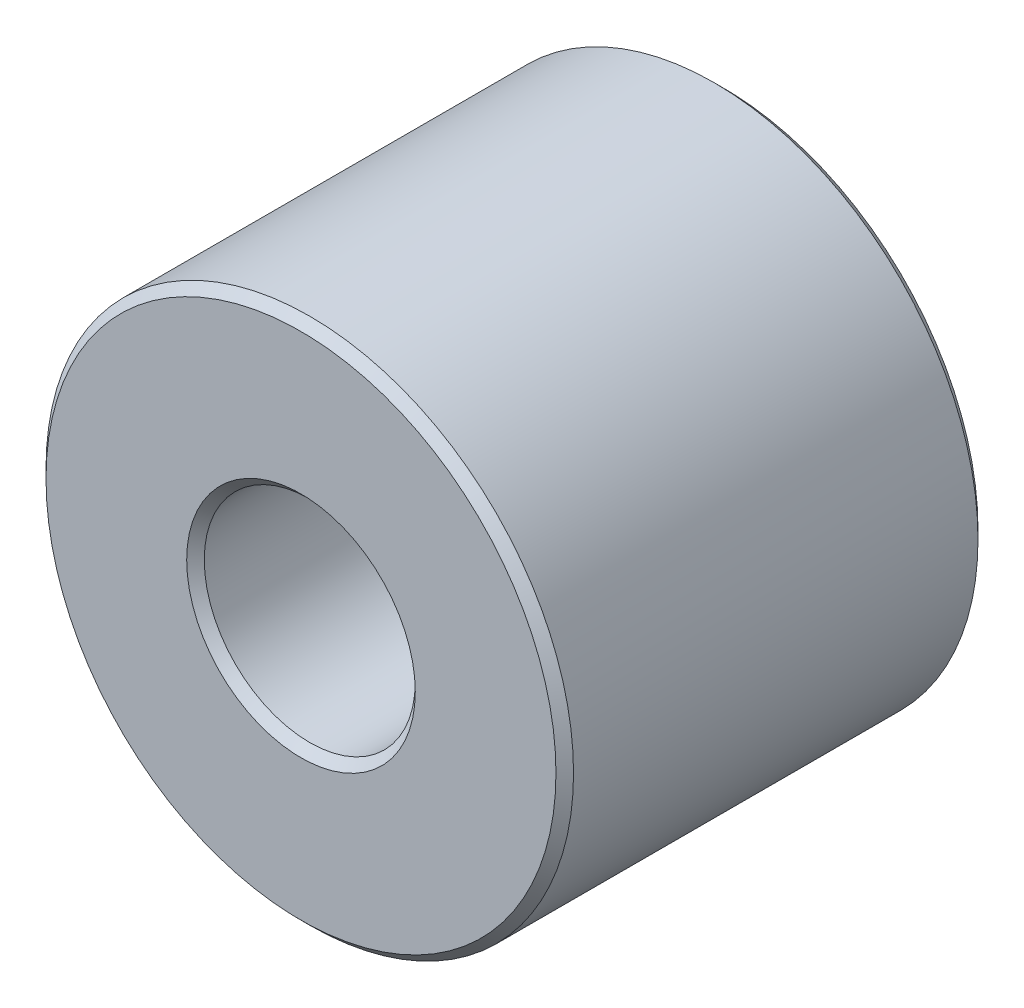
SolidWorks part; units mm, degrees
ref_plane "Спереди" through (0, 0, 0) normal (0, 0, 1) x (1, 0, 0)
ref_plane "Сверху" through (0, 0, 0) normal (0, 1, 0) x (1, 0, 0)
ref_plane "Справа" through (0, 0, 0) normal (1, 0, 0) x (0, 0, -1)
sketch "Эскиз1" plane through (0, 0, 0) normal (0, 0, 1) x (1, 0, 0)
  circle A0 centre (0, 0) radius 3
  circle A1 centre (0, 0) radius 7.5
  dimension "D1" = 15
  dimension "D2" = 6
extrude "Бобышка-Вытянуть1" add sketch "Эскиз1" along normal blind 12
chamfer "Фаска1" distance 0.25 angle 45 4 edges at (7.5, 0, 0) (7.5, 0, 12) (3, 0, 0) (3, 0, 12)
